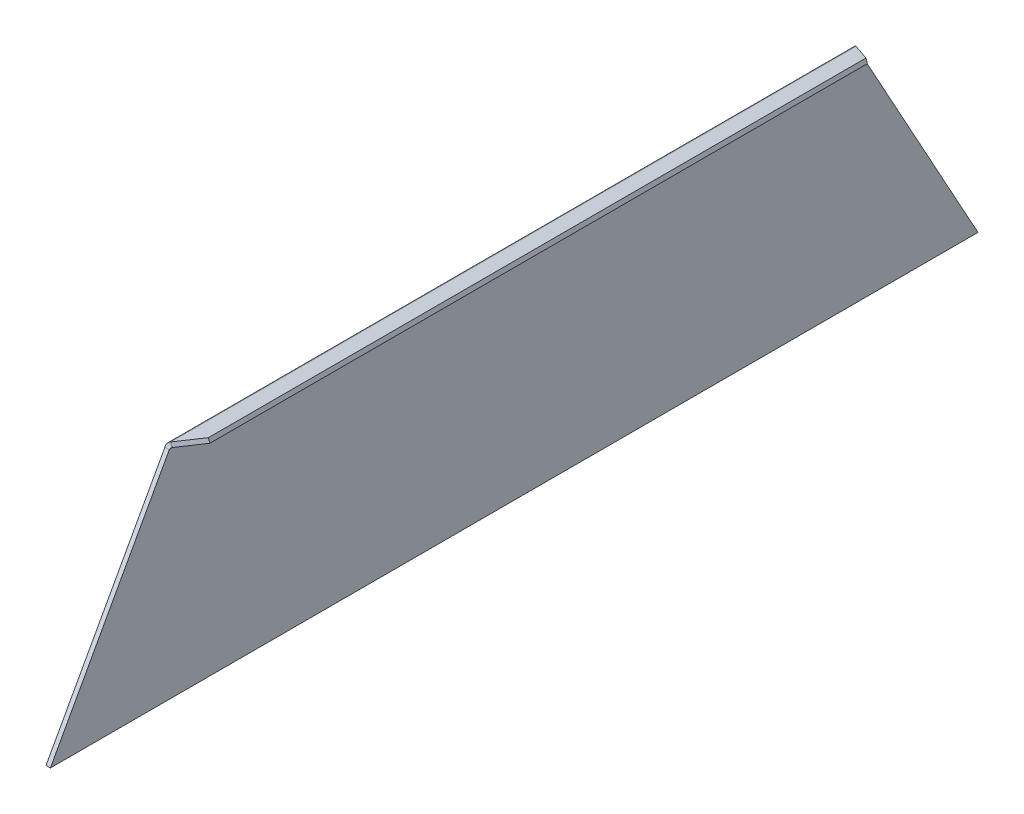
SolidWorks part; units mm, degrees
ref_plane "前视基准面" through (0, 0, 0) normal (0, 0, 1) x (1, 0, 0)
ref_plane "上视基准面" through (0, 0, 0) normal (0, 1, 0) x (1, 0, 0)
ref_plane "右视基准面" through (0, 0, 0) normal (1, 0, 0) x (0, 0, -1)
sketch "草图1" plane through (0, 0, 0) normal (1, 0, 0) x (0, 0, -1)
  line L0 (-850, 0) -> (850, 0)
  line L1 (-850, 0) -> (-602.5, 450)
  line L2 (850, 0) -> (602.5, 450)
  line L3 (-602.5, 450) -> (602.5, 450)
  line L4 (0, 0) -> (0, 450) construction
  dimension "D1" = 1700
  dimension "D2" = 850
  dimension "D3" = 450
  dimension "D4" = 1205
sheet metal parameters "钣金1" thickness 8 parameters "D1"=2
base flange "基体-法兰1" sketch "草图1" thickness 8 reverse thickness direction yes parameters "D1"=2
sketch "草图3" plane through (8, 0, 0) normal (1, 0, 0) x (0, 0, -1)
  line L2 (602.5, 400) -> (-602.5, 400)
  line L3 (602.5, 400) -> (-602.5, 400)
  dimension "D1" = 50
sketched bend "绘制的折弯1" parameters "D1"=2
bend "草图折弯1" bend radius 2 bend angle 70 parameters "D5"=1
flat pattern "平板型式1"
sketch "折弯-线1" plane through (0, 0, 0) normal (0, 1, 0) x (-1, 0, 0)
bend of the flat pattern "展开-<草图折弯1>1"
